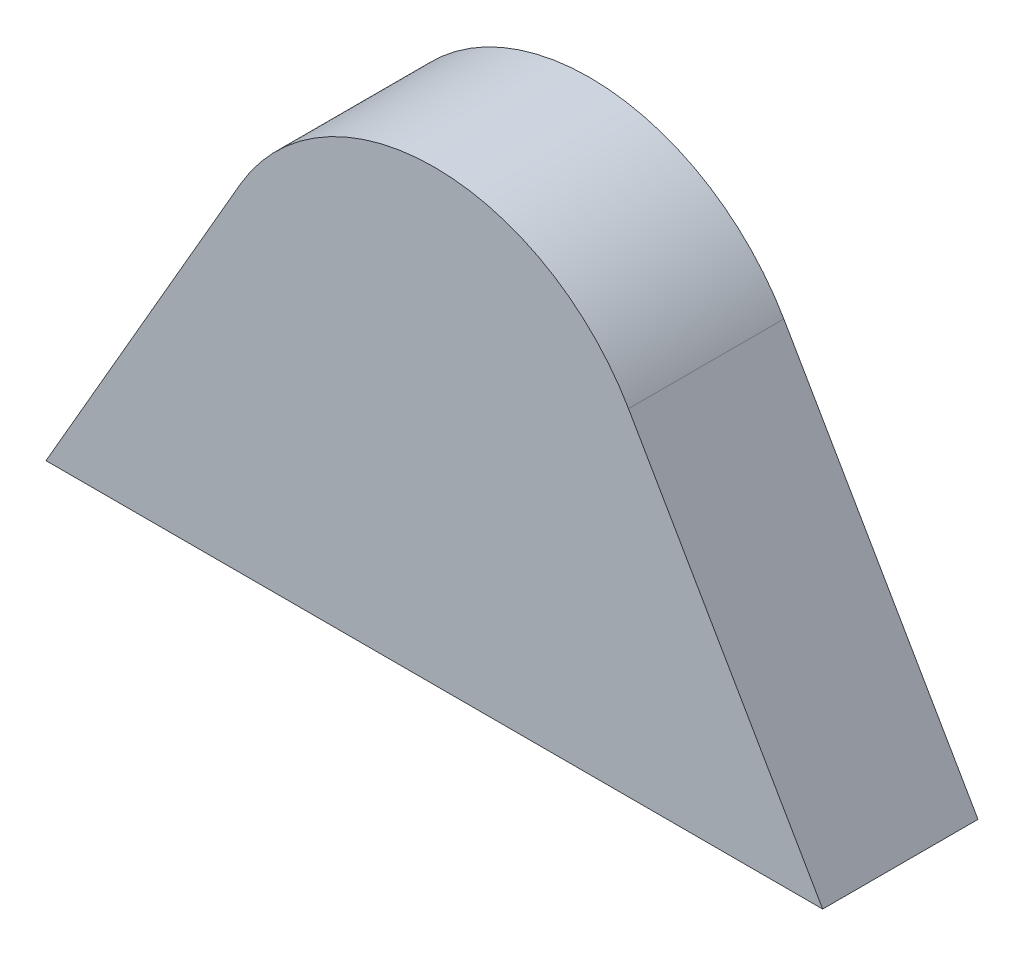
SolidWorks part; units mm, degrees
ref_plane "Front" through (0, 0, 0) normal (0, 0, 1) x (1, 0, 0)
ref_plane "Top" through (0, 0, 0) normal (0, 1, 0) x (1, 0, 0)
ref_plane "Right" through (0, 0, 0) normal (1, 0, 0) x (0, 0, -1)
sketch "Sketch1" plane through (0, 0, 0) normal (0, 0, 1) x (1, 0, 0)
  line L0 (0, 0) -> (50, 0)
  line L1 (50, 0) -> (25, 43.3013)
  line L2 (25, 43.3013) -> (0, 0)
  circle A0 centre (25, 14.4338) radius 14.4338
  dimension "D1" = 50
extrude "Extrude1" add sketch "Sketch1" along normal blind 10
